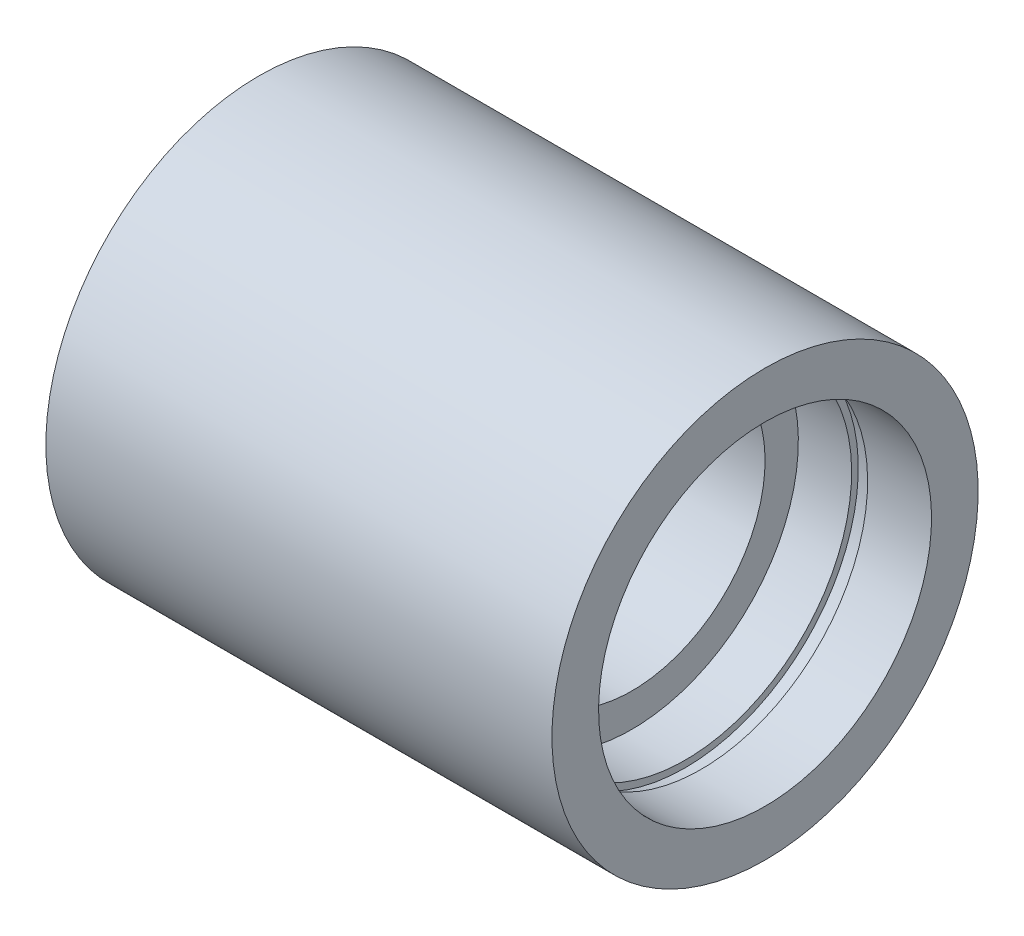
SolidWorks part; units mm, degrees
ref_plane "Plan1" through (0, 0, 0) normal (0, 0, 1) x (1, 0, 0)
ref_plane "Plan2" through (0, 0, 0) normal (0, 1, 0) x (1, 0, 0)
ref_plane "Plan3" through (0, 0, 0) normal (1, 0, 0) x (0, 0, -1)
sketch "Esquisse1" plane through (0, 0, 0) normal (0, 0, 1) x (1, 0, 0)
  line L0 (0, 0) -> (-40, 0) construction
  line L1 (0, 16) -> (0, 12.5)
  line L2 (0, 16) -> (-38, 16)
  line L3 (-38, 16) -> (-38, 12.5)
  line L4 (-38, 12.5) -> (-29, 12.5)
  line L5 (-29, 12.5) -> (-29, 4)
  line L6 (-29, 4) -> (-24, 4)
  line L7 (-24, 4) -> (-24, 10)
  line L8 (-24, 10) -> (-10, 10)
  line L9 (-10, 10) -> (-10, 12.5)
  line L10 (-10, 12.5) -> (-6, 12.5)
  line L11 (-6, 12.5) -> (-6, 13)
  line L12 (-6, 13) -> (-4.8, 13)
  line L13 (-4.8, 13) -> (-4.8, 12.5)
  line L14 (-4.8, 12.5) -> (0, 12.5)
  dimension "D1" = 1.2
  dimension "D2" = 0.5
  dimension "D3" = 25
  dimension "D4" = 32
  dimension "D5" = 4.8
  dimension "D6" = 25
  dimension "D7" = 8
  dimension "D8" = 9
  dimension "D9" = 38
  dimension "D10" = 10
  dimension "D11" = 14
  dimension "D12" = 20
revolve "Base-Révolution" add sketch "Esquisse1" angle 360 about L0
sketch "Esquisse2" plane through (-38, 0, 0) normal (-1, 0, 0) x (0, 0, 1)
  line L1 (0, 0) -> (16.9813, 0)
  line L2 (0, 0) -> (0, 17.664)
  line L3 (0, 17.664) -> (16.9813, 17.664)
  line L4 (16.9813, 0) -> (16.9813, 17.664)
extrude "Enlèv. mat.-Extru.1" cut sketch "Esquisse2" against normal through all
